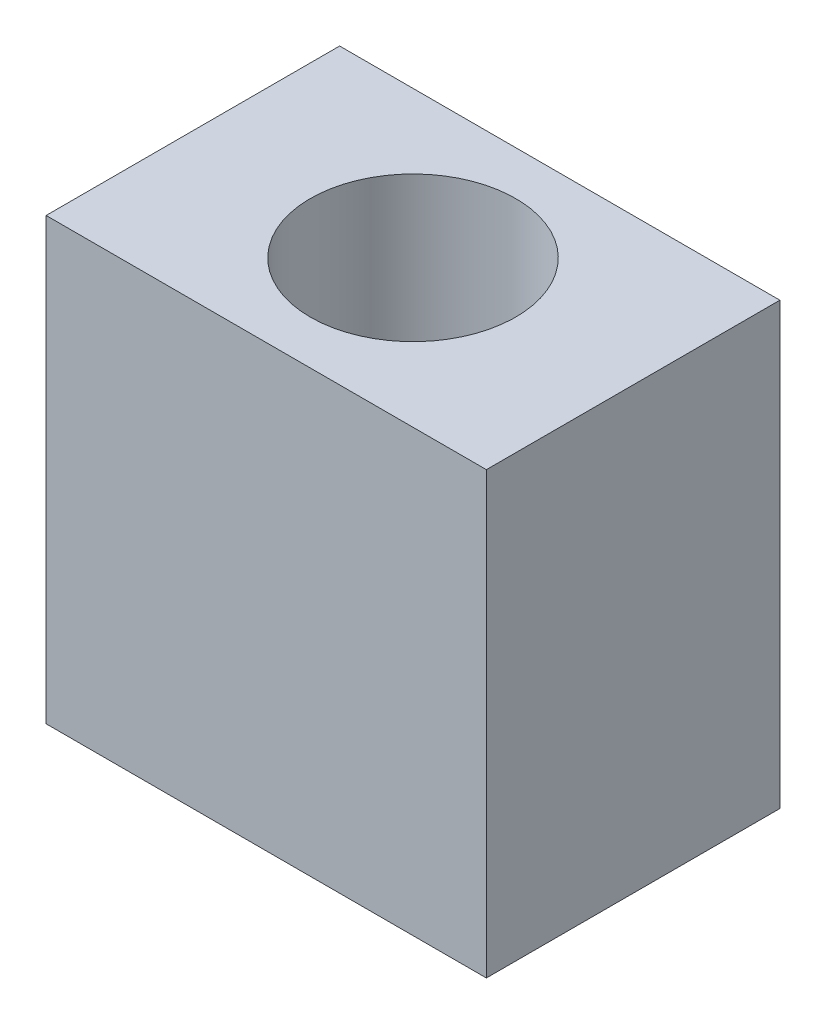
SolidWorks part; units mm, degrees
ref_plane "Face" through (0, 0, 0) normal (0, 0, 1) x (1, 0, 0)
ref_plane "Dessus" through (0, 0, 0) normal (0, 1, 0) x (1, 0, 0)
ref_plane "Droite" through (0, 0, 0) normal (1, 0, 0) x (0, 0, -1)
sketch "Esquisse2" plane through (0, 0, 0) normal (0, 0, 1) x (1, 0, 0)
  line L1 (0, 0) -> (30, 0)
  line L2 (0, 0) -> (0, -30)
  line L3 (0, -30) -> (30, -30)
  line L4 (30, 0) -> (30, -30)
  dimension "D1" = 30
  dimension "D2" = 30
extrude "Extrusion1" add sketch "Esquisse2" along normal blind 20
hole_wizard "Trou taraudé M161" positions "Esquisse4" profile "Esquisse3" tap size "M16" standard "ISO"
sketch "Esquisse4" plane through (0, 0, 0) normal (0, 1, 0) x (-1, 0, 0)
  line L0 (-30, 20) -> (-30, 0) construction
  line L1 (-30, 20) -> (0, 20) construction
  point P0 (-15, 10)
  dimension "D1" = 15
  dimension "D2" = 10
sketch "Esquisse3" plane through (15, 0, 10) normal (1, 0, 0) x (0, 0, 1)
  line L0 (0, 0) -> (0, 42.206)
  line L1 (0, 42.206) -> (7, 38)
  line L2 (7, 38) -> (7, 0)
  line L5 (7, 0) -> (0, 0)
  line L10 (0, 42.206) -> (-7, 38) construction
  line L11 (0, -6.35) -> (0, 107.95) construction
  dimension "Diamètre du trou pour taraudage" = 14
  dimension "Profondeur du trou pour taraudage" = 38
  dimension "Angle de pointe" = 118
